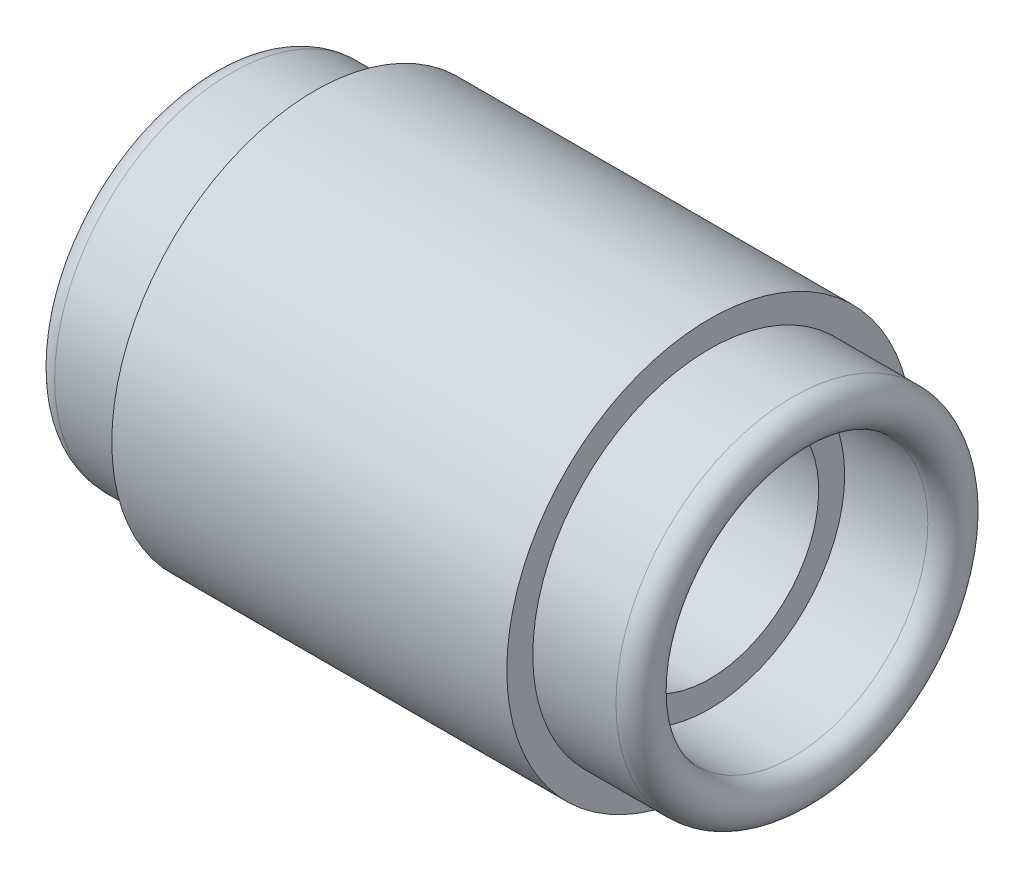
SolidWorks part; units mm, degrees
ref_plane "Face" through (0, 0, 0) normal (0, 0, 1) x (1, 0, 0)
ref_plane "Dessus" through (0, 0, 0) normal (0, 1, 0) x (1, 0, 0)
ref_plane "Droite" through (0, 0, 0) normal (1, 0, 0) x (0, 0, -1)
sketch "Esquisse1" plane through (0, 0, 0) normal (0, 0, 1) x (1, 0, 0)
  line L0 (0, 0) -> (112.9905, 0) construction
  line L1 (92, 34) -> (108, 34)
  line L2 (16, 39) -> (92, 39)
  line L3 (16, 39) -> (16, 34)
  line L4 (16, 21) -> (92, 21)
  line L5 (92, 39) -> (92, 34)
  line L6 (0, 34) -> (16, 34)
  line L7 (92, 26) -> (108, 26)
  line L8 (0, 26) -> (16, 26)
  line L9 (92, 26) -> (92, 21)
  line L10 (16, 26) -> (16, 21)
  line L11 (0, 0) -> (0, 46.0011) construction
  arc A0 (108, 26) -> (108, 34) centre (108, 30) ccw
  arc A1 (0, 34) -> (0, 26) centre (0, 30) ccw
  dimension "D4" = 116
  dimension "D5" = 4
  dimension "D1" = 76
  dimension "D2" = 78
  dimension "D3" = 42
revolve "Base-Révolution" add sketch "Esquisse1" angle 360 about L0
